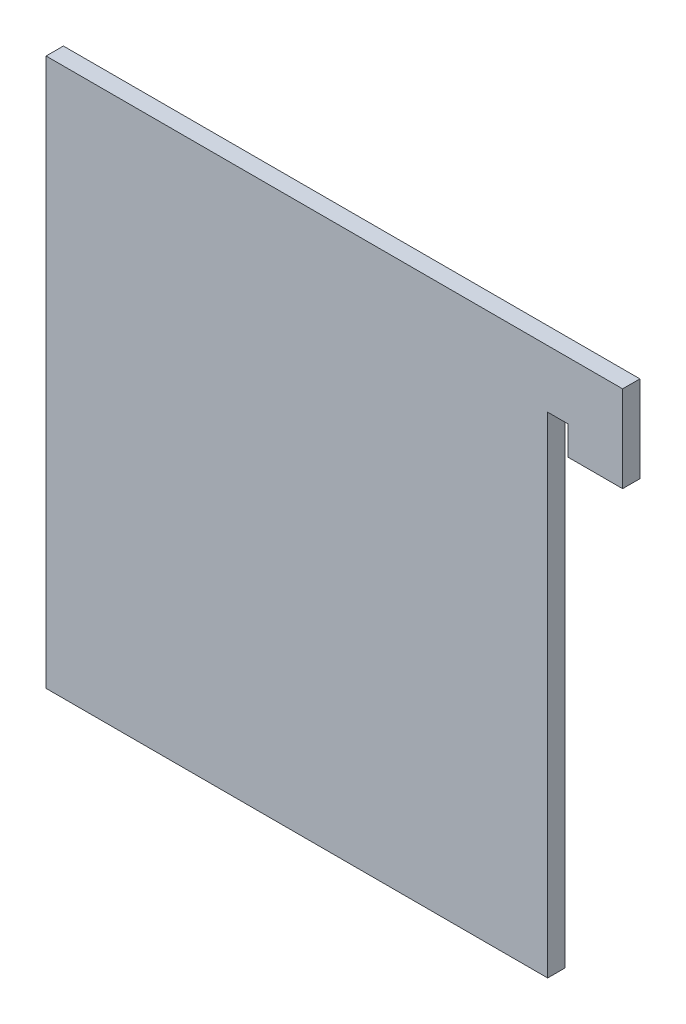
SolidWorks part; units mm, degrees
ref_plane "Plan de face" through (0, 0, 0) normal (0, 0, 1) x (1, 0, 0)
ref_plane "Plan de dessus" through (0, 0, 0) normal (0, 1, 0) x (1, 0, 0)
ref_plane "Plan de droite" through (0, 0, 0) normal (1, 0, 0) x (0, 0, -1)
sketch "Esquisse1" plane through (0, 0, 0) normal (0, 0, 1) x (1, 0, 0)
  line L1 (0, 0) -> (100, 0)
  line L2 (0, 0) -> (0, 95)
  line L3 (0, 95) -> (100, 95)
  line L4 (100, 0) -> (100, 95)
  dimension "D1" = 100
  dimension "D2" = 95
extrude "Extrusion1" add sketch "Esquisse1" along normal blind 3
sketch "Esquisse2" plane through (0, 0, 3) normal (0, 0, 1) x (1, 0, 0)
  line L1 (100, 0) -> (87, 0)
  line L2 (100, 0) -> (100, 80)
  line L3 (100, 80) -> (87, 80)
  line L4 (87, 0) -> (87, 80)
  dimension "D1" = 80
  dimension "D2" = 13
extrude "Enlèv. mat.-Extru.1" cut sketch "Esquisse2" against normal blind 3
sketch "Esquisse4" plane through (0, 0, 3) normal (0, 0, 1) x (1, 0, 0)
  line L1 (87, 80) -> (90.5, 80)
  line L2 (87, 80) -> (87, 85)
  line L3 (87, 85) -> (90.5, 85)
  line L4 (90.5, 80) -> (90.5, 85)
  dimension "D1" = 3.5
  dimension "D2" = 5
extrude "Enlèv. mat.-Extru.3" cut sketch "Esquisse4" against normal blind 3
